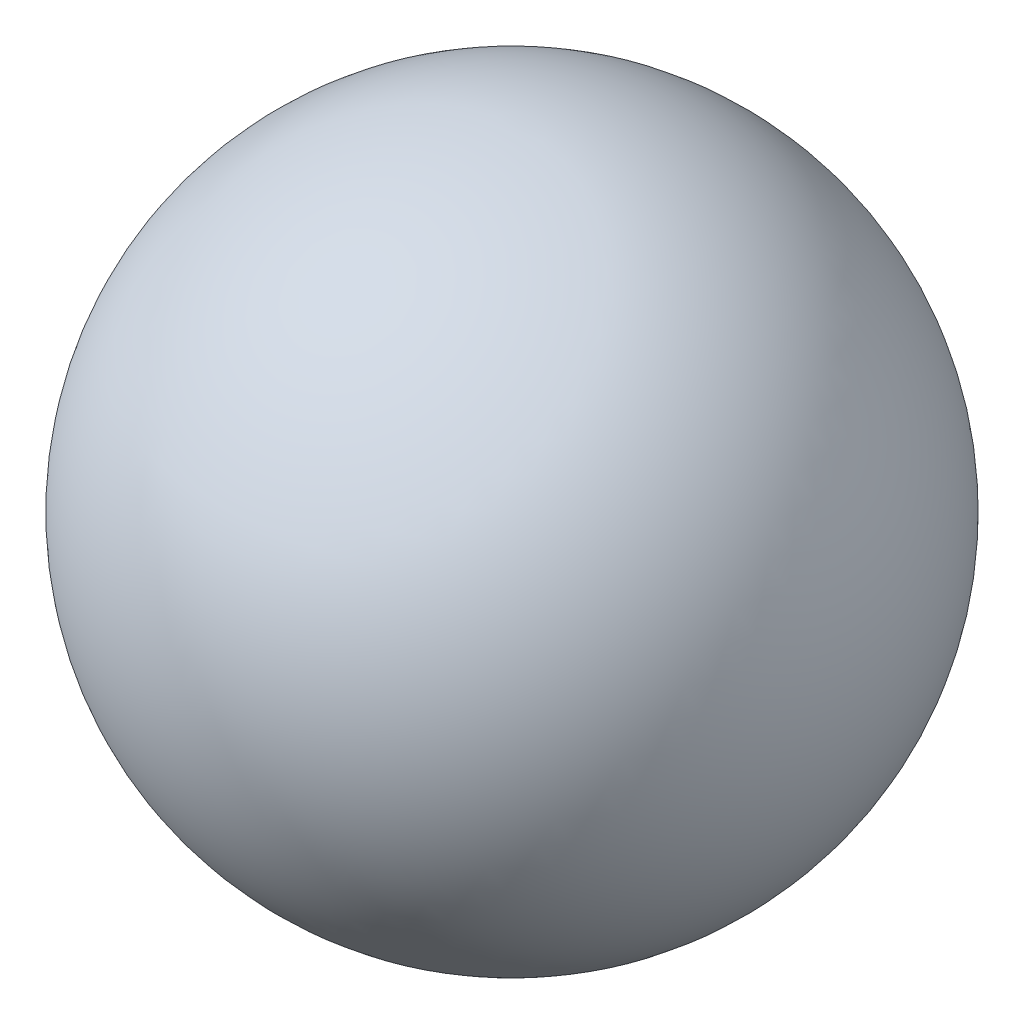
SolidWorks part; units mm, degrees
ref_plane "Ebene vorne" through (0, 0, 0) normal (0, 0, 1) x (1, 0, 0)
ref_plane "Ebene oben" through (0, 0, 0) normal (0, 1, 0) x (1, 0, 0)
ref_plane "Ebene rechts" through (0, 0, 0) normal (1, 0, 0) x (0, 0, -1)
sketch "Skizze1" plane through (0, 0, 0) normal (1, 0, 0) x (0, 0, -1)
  line L0 (0, 15) -> (0, -15) construction
  arc A0 (0, -15) -> (0, 15) centre (0, 0) ccw
  dimension "D1" = 30
revolve "Rotation1" add sketch "Skizze1" angle 360 about L0
